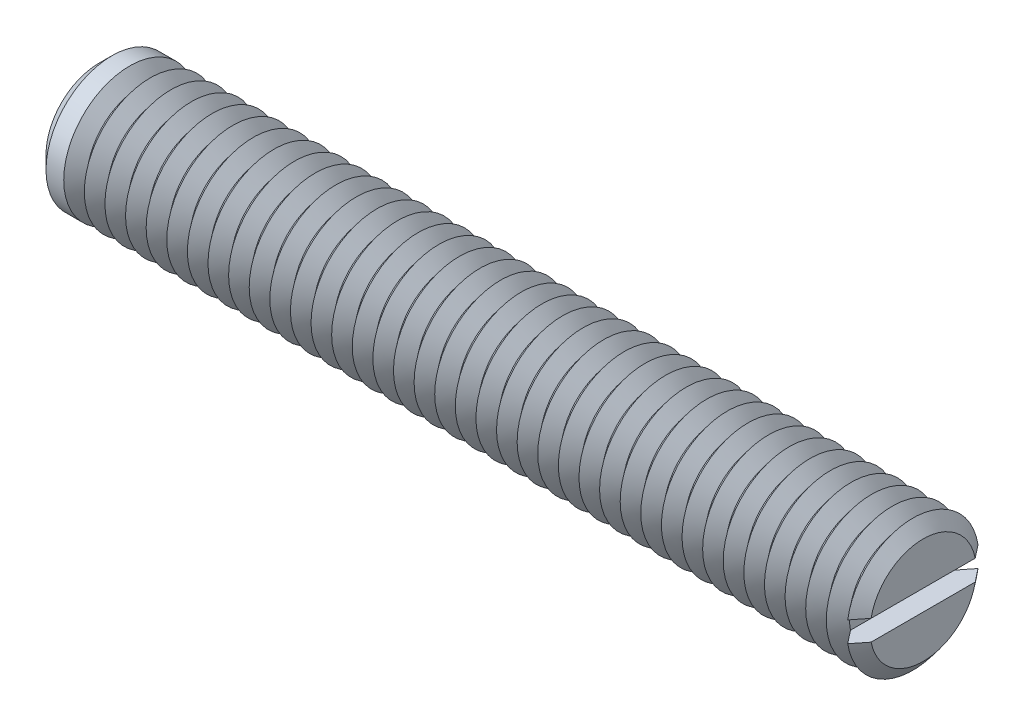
SolidWorks part; units mm, degrees
ref_plane "Front Plane" through (0, 0, 0) normal (0, 0, 1) x (1, 0, 0)
ref_plane "Top Plane" through (0, 0, 0) normal (0, 1, 0) x (1, 0, 0)
ref_plane "Right Plane" through (0, 0, 0) normal (1, 0, 0) x (0, 0, -1)
sketch "Sketch1" plane through (0, 0, 0) normal (1, 0, 0) x (0, 0, -1)
  circle A0 centre (0, 0) radius 4
  dimension "D1" = 8
extrude "Extrude1" add sketch "Sketch1" along normal mid plane 50
sketch "Sketch2" plane through (0, 0, 0) normal (0, 0, 1) x (1, 0, 0)
  line L0 (25, 0.625) -> (23.75, 0.625)
  line L1 (25, -4) -> (25, 4) construction
  line L2 (23.75, 0.625) -> (23.75, -0.625)
  line L3 (0, 0) -> (50000, 0) construction
  line L4 (25, -0.625) -> (23.75, -0.625)
  line L5 (25, -0.625) -> (25, 0.625)
  point P9 (23.75, 0)
  dimension "D1" = 1.25
extrude "Extrude2" cut sketch "Sketch2" against normal mid plane 12
chamfer "Chamfer1" distance 0.8 angle 45 1 edges at (-25, 0, -4)
sketch "Sketch3" plane through (0, 0, 0) normal (0, 0, 1) x (1, 0, 0)
  line L0 (0, 0) -> (30.9602, 0) construction
  line L1 (24.375, -4) -> (25.625, -4)
  line L2 (-24.2, -4) -> (25, -4) construction
  line L3 (25.625, -4) -> (25, -3.2194)
  line L4 (25, -4) -> (25, -0.625) construction
  line L5 (25, -3.2194) -> (24.375, -4)
  dimension "D1" = 1.25
  dimension "D2" = 1
revolve "Cut-Revolve1" cut sketch "Sketch3" angle 360 about L0
pattern_linear "LPattern1" count 39 spacing 1.25 along (-1, 0, 0) of "Cut-Revolve1"
equation "\"D2@Sketch3\" = \"D1@Sketch3\"*0.8"
